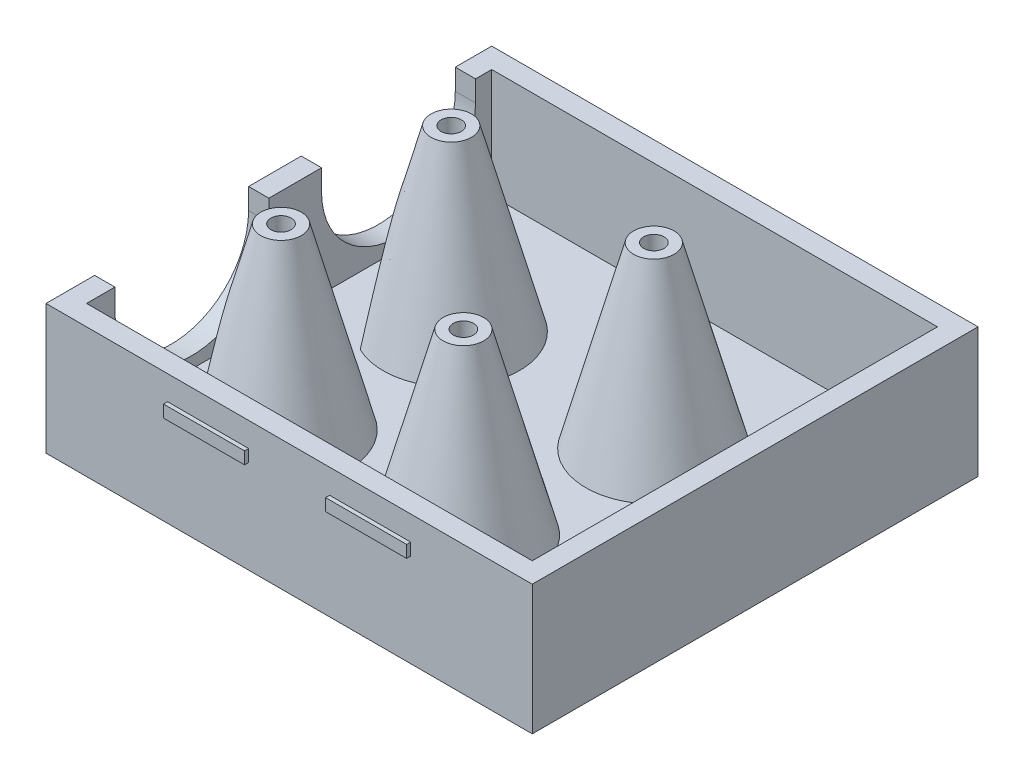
SolidWorks part; units mm, degrees
ref_plane "Front Plane" through (0, 0, 0) normal (0, 0, 1) x (1, 0, 0)
ref_plane "Top Plane" through (0, 0, 0) normal (0, 1, 0) x (1, 0, 0)
ref_plane "Right Plane" through (0, 0, 0) normal (1, 0, 0) x (0, 0, -1)
sketch "Sketch1" plane through (0, 0, 0) normal (0, 1, 0) x (1, 0, 0)
  line L1 (-26.3578, 41.2061) -> (33.6422, 41.2061)
  line L2 (-26.3578, 41.2061) -> (-26.3578, -13.7939)
  line L3 (-26.3578, -13.7939) -> (33.6422, -13.7939)
  line L4 (33.6422, 41.2061) -> (33.6422, -13.7939)
  dimension "D1" = 60
  dimension "D2" = 55
extrude "Boss-Extrude1" add sketch "Sketch1" along normal blind 2.5
sketch "Sketch3" plane through (0, 2.5, 0) normal (0, 1, 0) x (1, 0, 0)
  line L0 (33.6422, -13.7939) -> (33.6422, 41.2061) construction
  line L1 (-26.3578, -13.7939) -> (33.6422, -13.7939) construction
  line L2 (-26.3578, 41.2061) -> (-26.3578, -13.7939) construction
  line L3 (33.6422, 41.2061) -> (-26.3578, 41.2061) construction
  line L4 (33.6422, -13.7939) -> (33.6422, 41.2061)
  line L5 (-26.3578, -13.7939) -> (33.6422, -13.7939)
  line L6 (-26.3578, 41.2061) -> (-26.3578, -13.7939)
  line L7 (33.6422, 41.2061) -> (-26.3578, 41.2061)
  line L8 (31.1422, -11.2939) -> (31.1422, 38.7061)
  line L9 (31.1422, 38.7061) -> (-23.8578, 38.7061)
  line L10 (-23.8578, 38.7061) -> (-23.8578, -11.2939)
  line L11 (-23.8578, -11.2939) -> (31.1422, -11.2939)
  dimension "D1" = 2.5
extrude "Boss-Extrude2" add sketch "Sketch3" along normal blind 13.5
sketch "Sketch4" plane through (0, 2.5, 0) normal (0, 1, 0) x (1, 0, 0)
  line L0 (-37.4158, 0.7061) -> (26.4507, 0.7061) construction
  line L1 (10.6422, 4.9182) -> (10.6422, -9.6068) construction
  line L2 (-11.8578, 4.9182) -> (-11.8578, -9.6068) construction
  line L3 (-23.8578, 38.7061) -> (-23.8578, -11.2939) construction
  line L4 (-23.8578, -11.2939) -> (31.1422, -11.2939) construction
  circle A0 centre (-11.8578, 0.7061) radius 2.5
  circle A1 centre (10.6422, 0.7061) radius 2.5
  circle A2 centre (-11.8578, 21.7061) radius 2.5
  circle A3 centre (13.1422, 21.7061) radius 2.5
  dimension "D1" = 5
  dimension "D2" = 22.5
  dimension "D3" = 12
  dimension "D4" = 12
  dimension "D5" = 21
  dimension "D6" = 2.5
extrude "Boss-Extrude3" add sketch "Sketch4" along normal blind 22
ref_plane "Plane1" through (0, 0, -0.7061) normal (0, 0, 1) x (0, -1, 0)
sketch "Sketch5" plane through (0, 0, -0.7061) normal (0, 0, 1) x (0, -1, 0)
  line L0 (-24.5, -9.3578) -> (-2.5, -9.3578)
  line L1 (-2.5, -23.8578) -> (-2.5, 31.1422) construction
  line L2 (-2.5, -9.3578) -> (-24.5, -9.3578) construction
  line L3 (-2.5, -9.3578) -> (-2.5, -3.4629)
  line L4 (-2.5, -3.4629) -> (-24.5, -9.3578)
  dimension "D1" = 15
revolve "Revolve1" add sketch "Sketch5" angle 360 about axis through (-11.8578, 24.5, -0.7061) along (0, -1, 0)
sketch "Sketch6" plane through (0, 0, -0.7061) normal (0, 0, 1) x (0, -1, 0)
  line L0 (-24.5, 13.1422) -> (-2.5, 13.1422)
  line L1 (-2.5, 13.1422) -> (-2.5, 19.0371)
  line L2 (-2.5, -23.8578) -> (-2.5, 31.1422) construction
  line L3 (-2.5, 19.0371) -> (-24.5, 13.1422)
  dimension "D1" = 15
revolve "Revolve2" add sketch "Sketch6" angle 360 about axis through (10.6422, 24.5, -0.7061) along (0, -1, 0)
sketch "Sketch7" plane through (0, 24.5, 0) normal (0, 1, 0) x (1, 0, 0)
  circle A0 centre (10.6422, 0.7061) radius 1.25
  dimension "D1" = 2.5
extrude "Cut-Extrude1" cut sketch "Sketch7" against normal blind 10
sketch "Sketch8" plane through (0, 24.5, 0) normal (0, 1, 0) x (1, 0, 0)
  circle A0 centre (-11.8578, 0.7061) radius 1.25
  dimension "D1" = 2.5
extrude "Cut-Extrude2" cut sketch "Sketch8" against normal blind 10
ref_plane "Plane2" through (0, 0, -21.7061) normal (0, 0, 1) x (1, 0, 0)
sketch "Sketch9" plane through (0, 0, -21.7061) normal (0, 0, 1) x (1, 0, 0)
  line L0 (-9.3578, 24.5) -> (-3.4629, 2.5)
  line L1 (-23.8578, 2.5) -> (31.1422, 2.5) construction
  line L2 (-3.4629, 2.5) -> (-9.3578, 2.5)
  line L3 (-9.3578, 2.5) -> (-9.3578, 24.5)
  dimension "D1" = 15
revolve "Revolve3" add sketch "Sketch9" angle 360 about axis through (-11.8578, 24.5, -21.7061) along (0, -1, 0)
sketch "Sketch10" plane through (0, 0, -21.7061) normal (0, 0, 1) x (1, 0, 0)
  line L0 (15.6422, 24.5) -> (15.6422, 2.5)
  line L1 (15.6422, 2.5) -> (21.5371, 2.5)
  line L2 (21.5371, 2.5) -> (15.6422, 24.5)
  dimension "D1" = 15
revolve "Revolve4" add sketch "Sketch10" angle 360 about axis through (13.1422, 24.5, -21.7061) along (0, -1, 0)
sketch "Sketch11" plane through (0, 24.5, 0) normal (0, 1, 0) x (1, 0, 0)
  circle A0 centre (-11.8578, 21.7061) radius 1.25
  dimension "D1" = 2.5
extrude "Cut-Extrude3" cut sketch "Sketch11" against normal blind 10
sketch "Sketch12" plane through (0, 24.5, 0) normal (0, 1, 0) x (1, 0, 0)
  circle A0 centre (13.1422, 21.7061) radius 1.25
  dimension "D1" = 2.5
extrude "Cut-Extrude4" cut sketch "Sketch12" against normal blind 10
sketch "Sketch13" plane through (-26.3578, 0, 0) normal (-1, 0, 0) x (0, 0, 1)
  line L1 (-17.7061, 16) -> (-17.7061, 13.4172)
  line L2 (-11.2061, 16) -> (-11.2061, 13.4172)
  line L3 (7.7939, 16) -> (7.7939, 13.4172)
  line L4 (-36.7061, 16) -> (-36.7061, 13.4172)
  line L5 (-36.7061, 16) -> (-17.7061, 16)
  line L6 (-11.2061, 16) -> (7.7939, 16)
  arc A0 (-36.7061, 13.4172) -> (-17.7061, 13.4172) centre (-27.2061, 13.4172) ccw
  arc A2 (-11.2061, 13.4172) -> (7.7939, 13.4172) centre (-1.7061, 13.4172) ccw
extrude "Cut-Extrude5" cut sketch "Sketch13" against normal up to surface (2.5 mm away)
sketch "Sketch14" plane through (0, 0, 13.7939) normal (0, 0, 1) x (1, 0, 0)
  line L0 (-26.3578, 16) -> (-26.3578, 0) construction
  line L1 (-11.3578, 13) -> (-1.3578, 13)
  line L2 (-11.3578, 13) -> (-11.3578, 11.5)
  line L3 (-11.3578, 11.5) -> (-1.3578, 11.5)
  line L4 (-1.3578, 13) -> (-1.3578, 11.5)
  line L5 (8.6422, 13) -> (18.6422, 13)
  line L6 (8.6422, 13) -> (8.6422, 11.5)
  line L7 (8.6422, 11.5) -> (18.6422, 11.5)
  line L8 (18.6422, 13) -> (18.6422, 11.5)
  line L9 (-26.3578, 16) -> (33.6422, 16) construction
  dimension "D1" = 1.5
  dimension "D2" = 10
  dimension "D3" = 10
  dimension "D4" = 10
  dimension "D5" = 15
  dimension "D6" = 3
extrude "Boss-Extrude4" add sketch "Sketch14" along normal blind 0.5
sketch "Sketch15" plane through (0, 0, -41.2061) normal (0, 0, -1) x (-1, 0, 0)
  line L1 (1.3578, 13) -> (11.3578, 13)
  line L2 (1.3578, 13) -> (1.3578, 11.5)
  line L3 (1.3578, 11.5) -> (11.3578, 11.5)
  line L4 (11.3578, 13) -> (11.3578, 11.5)
  line L5 (-18.6422, 13) -> (-8.6422, 13)
  line L6 (-18.6422, 13) -> (-18.6422, 11.5)
  line L7 (-18.6422, 11.5) -> (-8.6422, 11.5)
  line L8 (-8.6422, 13) -> (-8.6422, 11.5)
extrude "Boss-Extrude5" add sketch "Sketch15" along normal blind 0.5
sketch "Sketch16" plane through (0, 24.5, 0) normal (0, 1, 0) x (1, 0, 0)
  line L1 (-15.5361, 33.5872) -> (-21.8544, 33.5872)
  line L2 (-15.5361, 33.5872) -> (-15.5361, -8.4175)
  line L3 (-15.5361, -8.4175) -> (-21.8544, -8.4175)
  line L4 (-21.8544, 33.5872) -> (-21.8544, -8.4175)
extrude "Cut-Extrude6" cut sketch "Sketch16" against normal up to surface (22 mm away)
